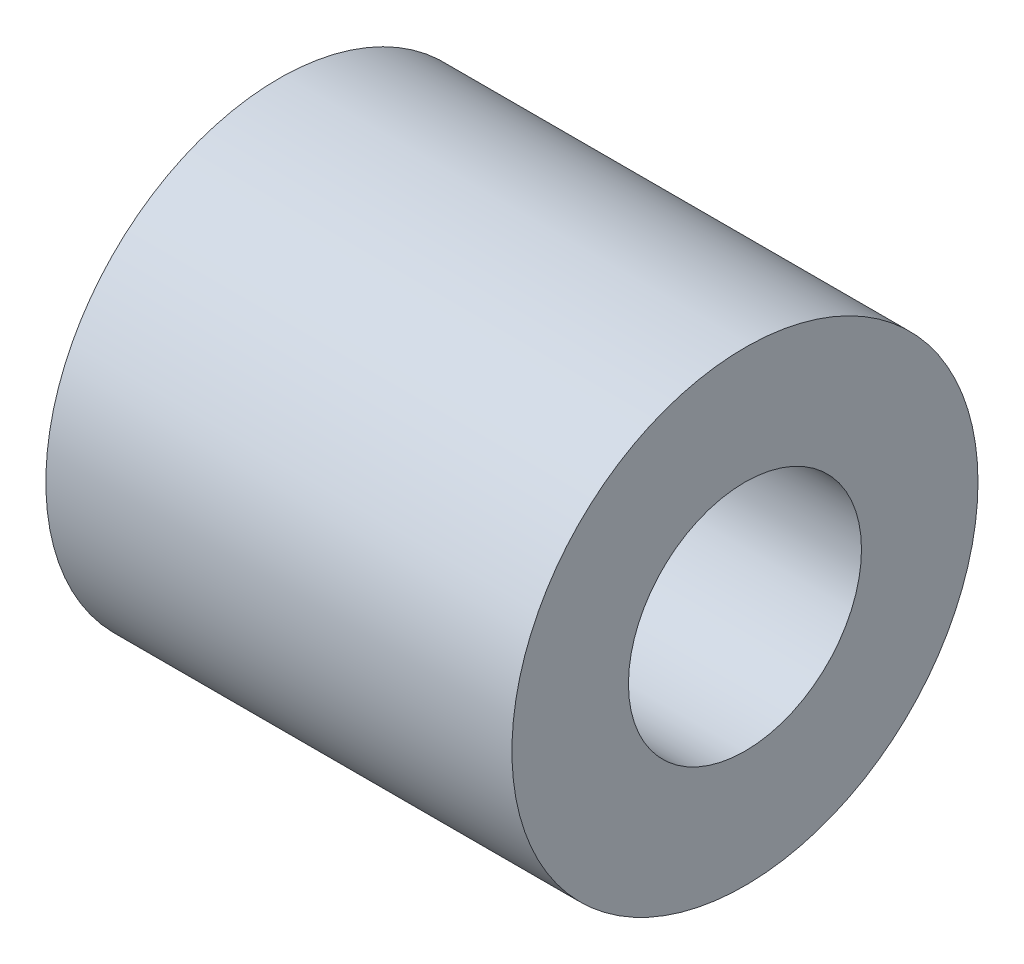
SolidWorks part; units mm, degrees
ref_plane "Front Plane" through (0, 0, 0) normal (1, 0, 0) x (0, 1, 0)
ref_plane "Top Plane" through (0, 0, 0) normal (0, 0, 1) x (0, 1, 0)
ref_plane "Right Plane" through (0, 0, 0) normal (0, 1, 0) x (-1, 0, 0)
sketch "Sketch1" plane through (0, 0, 0) normal (1, 0, 0) x (0, 1, 0)
  circle A0 centre (0, 0) radius 1.5875
  circle A1 centre (0, 0) radius 3.175
  dimension "D1" = 3.175
  dimension "D2" = 6.35
extrude "Boss-Extrude1" add sketch "Sketch1" along normal blind 6.35
